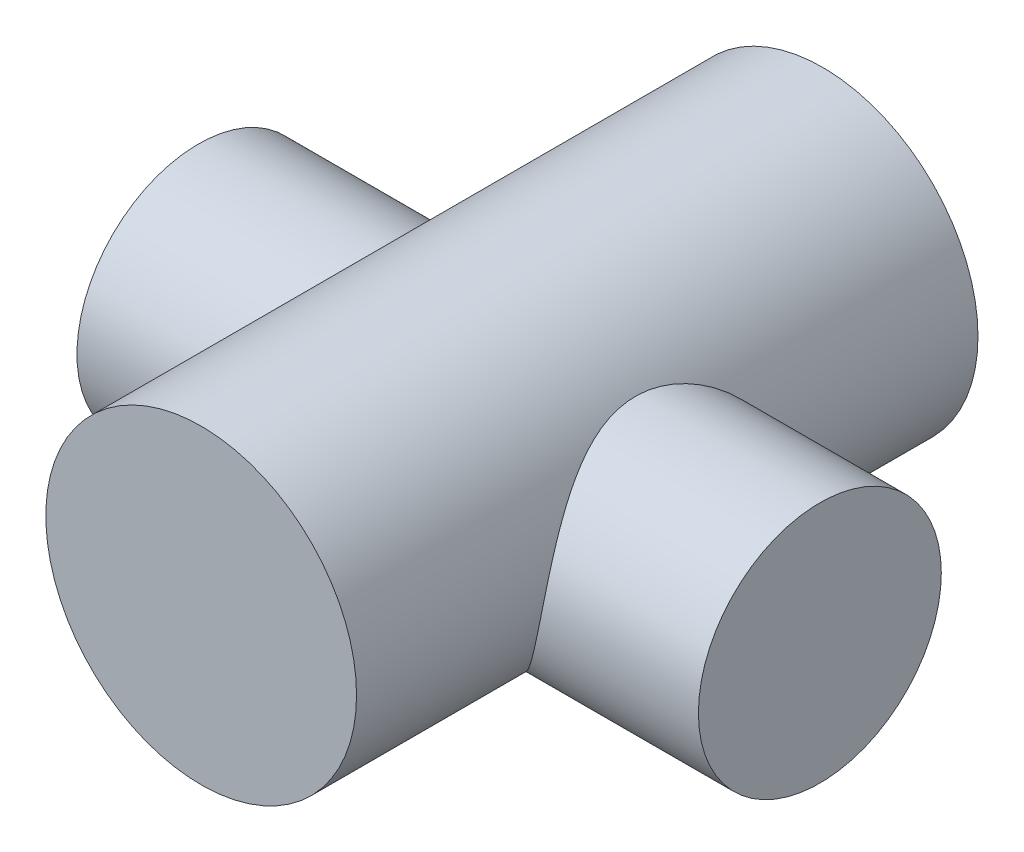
SolidWorks part; units mm, degrees
ref_plane "前视基准面" through (0, 0, 0) normal (0, 0, 1) x (1, 0, 0)
ref_plane "上视基准面" through (0, 0, 0) normal (0, 1, 0) x (1, 0, 0)
ref_plane "右视基准面" through (0, 0, 0) normal (1, 0, 0) x (0, 0, -1)
sketch "草图1" plane through (0, 0, 0) normal (0, 0, 1) x (1, 0, 0)
  circle A0 centre (0, 0) radius 10
  dimension "D1" = 20
extrude "拉伸1" add sketch "草图1" along normal blind 40
sketch "草图2" plane through (0, 0, 0) normal (1, 0, 0) x (0, 0, -1)
  line L0 (5.4902, -2) -> (-39.9643, -2) construction
  line L1 (-20.1783, 8.3387) -> (-20.1783, -15.369) construction
  line L2 (-40, -10) -> (0, -10) construction
  circle A0 centre (-20.1783, -2) radius 7.8174
  point P4 (-20.1783, -2)
  point P5 (-20.1783, -2)
  dimension "D1" = 8
extrude "拉伸2" add sketch "草图2" along normal mid plane 40
